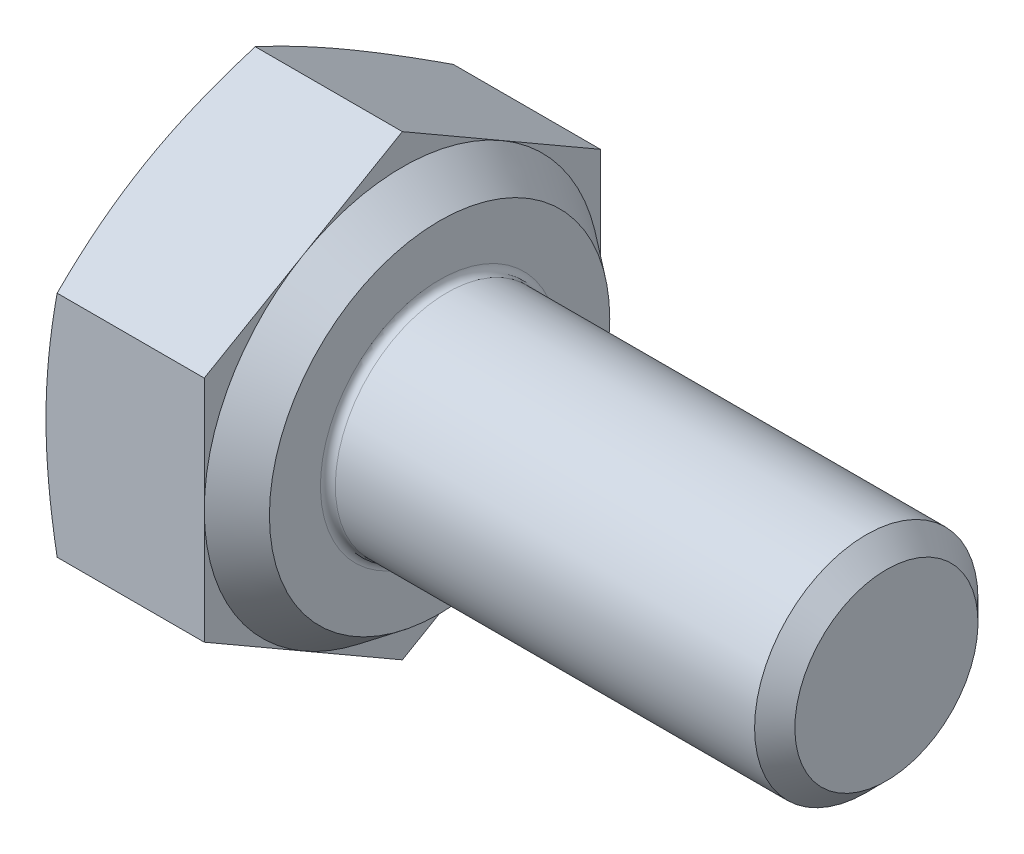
SolidWorks part; units mm, degrees
ref_plane "Front" through (0, 0, 0) normal (0, 0, 1) x (1, 0, 0)
ref_plane "Top" through (0, 0, 0) normal (0, 1, 0) x (1, 0, 0)
ref_plane "Right" through (0, 0, 0) normal (1, 0, 0) x (0, 0, -1)
sketch "Sketch-BaseHead" plane through (0, 0, 0) normal (1, 0, 0) x (0, 0, -1)
  line L1 (0, -3.0715) -> (2.66, -1.5358)
  line L2 (2.66, -1.5358) -> (2.66, 1.5358)
  line L3 (2.66, 1.5358) -> (0, 3.0715)
  line L4 (0, 3.0715) -> (-2.66, 1.5358)
  line L5 (-2.66, 1.5358) -> (-2.66, -1.5358)
  line L6 (-2.66, -1.5358) -> (0, -3.0715)
  circle A0 centre (0, 0) radius 2.66 construction
  dimension "s" = 5.32
extrude "BaseHead" add sketch "Sketch-BaseHead" along normal blind 2.125
sketch "Sketch4" plane through (-0.2646, -5.9169, 0) normal (0, 0, 1) x (0, 1, 0)
  line L0 (5.9169, 3.7369) -> (5.9169, -10.4477) construction
  line L2 (8.9884, -0.2646) -> (8.5769, -0.2646)
  line L4 (8.5769, -0.2646) -> (8.9884, -0.4144)
  line L6 (8.9884, -0.4144) -> (8.9884, -0.2646)
  dimension "D1" = 20
  dimension "D2" = 5.32
revolve "HeadChamfer" cut sketch "Sketch4" angle 360 about L0
sketch "Sketch1" plane through (0, 0, 0) normal (0, 1, 0) x (1, 0, 0)
  line L0 (2.125, 0) -> (2.625, 0)
  line L1 (2.625, 0) -> (2.625, 2.285)
  line L2 (2.625, 2.285) -> (2.125, 2.66)
  line L3 (2.125, 2.66) -> (2.125, 0)
  line L4 (-4.0016, 0) -> (10.1831, 0) construction
  dimension "D1" = 2.66
  dimension "D2" = 2.285
  dimension "D3" = 0.5
revolve "Revolve1" add sketch "Sketch1" angle 360 about axis through (-4.0016, 0, 0) along (1, 0, 0)
sketch "Sketch3" plane through (2.625, 0, 0) normal (1, 0, 0) x (0, 0, -1)
  circle A0 centre (0, 0) radius 1.5
  dimension "d" = 3
extrude "BaseBody" add sketch "Sketch3" along normal blind 6
chamfer "Chamfer1" distance 0.2705 angle 45 1 edges at (8.625, 1.5, 0)
fillet "HeadFillet" radius 0.1 1 edges at (2.625, -1.5, 0)
equation "\"D1@Sketch1\" = \"s@Sketch-BaseHead\" / 2 "
equation "\"D2@Sketch4\" = \"s@Sketch-BaseHead\""
equation "\"D1@Chamfer1\" =  ( \"d@Sketch3\" - \"D2@ThreadCosmetic1\" ) / 2 "
